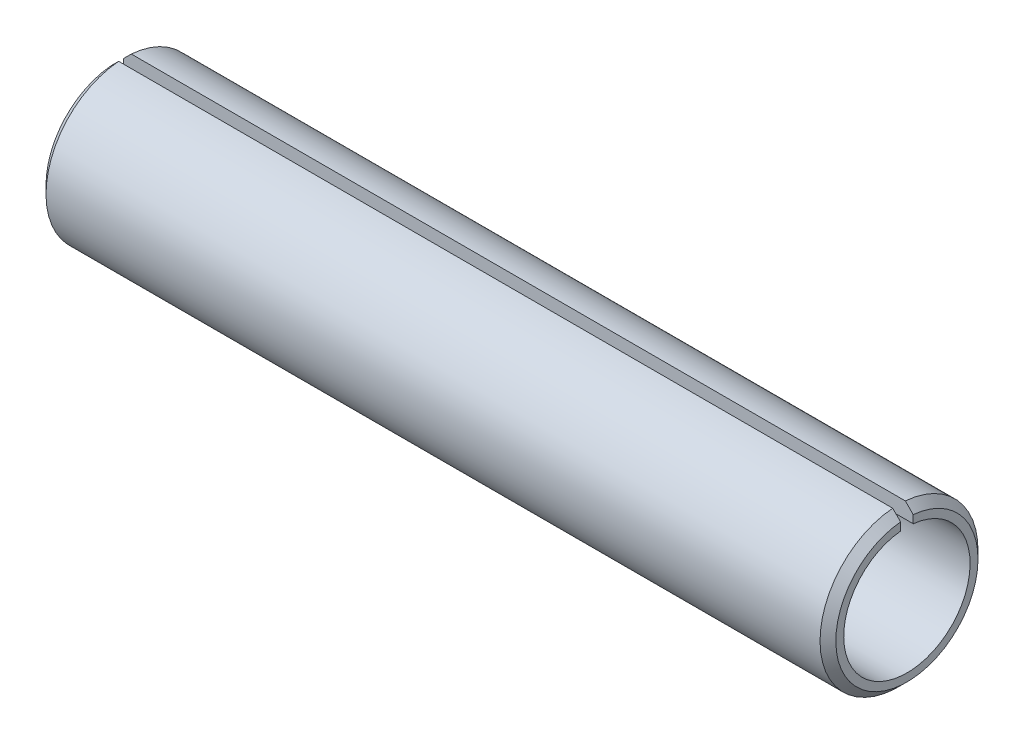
SolidWorks part; units mm, degrees
ref_plane "Plan1" through (0, 0, 0) normal (0, 0, 1) x (1, 0, 0)
ref_plane "Plan2" through (0, 0, 0) normal (0, 1, 0) x (1, 0, 0)
ref_plane "Plan3" through (0, 0, 0) normal (1, 0, 0) x (0, 0, -1)
sketch "Esquisse1" plane through (0, 0, 0) normal (0, 0, 1) x (1, 0, 0)
  line L0 (0, 2) -> (0, 2.25)
  line L1 (0, 2) -> (25, 2)
  line L2 (25, 2) -> (25, 2.25)
  line L3 (25, 2.25) -> (24.75, 2.5)
  line L4 (24.75, 2.5) -> (0.25, 2.5)
  line L5 (0.25, 2.5) -> (0, 2.25)
  line L6 (0, 0) -> (25, 0) construction
  dimension "D1" = 25
  dimension "D2" = 2.5
  dimension "D3" = 0.5
  dimension "D4" = 45
  dimension "D5" = 45
  dimension "D6" = 0.25
revolve "Base-Révolution" add sketch "Esquisse1" angle 360 about L6
sketch "Esquisse2" plane through (0, 0, 0) normal (1, 0, 0) x (0, 0, -1)
  line L0 (0, 0) -> (0, 2.5) construction
  line L1 (0.2, 2.492) -> (0.2, 1.99)
  line L2 (-0.2, 2.492) -> (-0.2, 1.99)
  circle A0 centre (0, 0) radius 2.5 construction
  circle A1 centre (0, 0) radius 2 construction
  arc A2 (0.2, 1.99) -> (-0.2, 1.99) centre (0, 0) ccw
  arc A3 (0.2, 2.492) -> (-0.2, 2.492) centre (0, 0) ccw
  dimension "D1" = 0.2
extrude "Enlèv. mat.-Extru.2" cut sketch "Esquisse2" along normal through all
equation "\"D6@Esquisse1\"=\"D2@Esquisse1\"/10"
equation "\"D1@Esquisse2\"=\"D3@Esquisse1\"/2.5"
